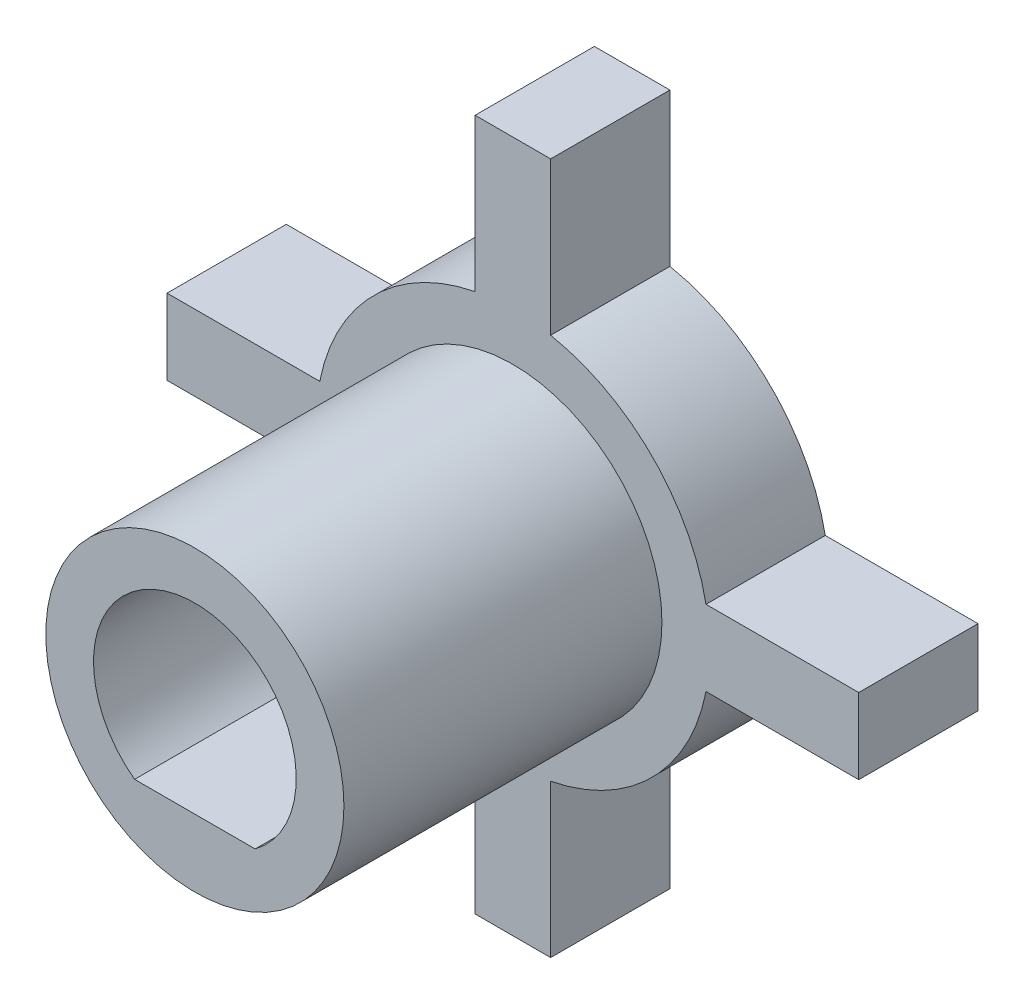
SolidWorks part; units mm, degrees
ref_plane "前视基准面" through (0, 0, 0) normal (0, 0, 1) x (1, 0, 0)
ref_plane "上视基准面" through (0, 0, 0) normal (0, 1, 0) x (1, 0, 0)
ref_plane "右视基准面" through (0, 0, 0) normal (1, 0, 0) x (0, 0, -1)
other "Configuration Table"
sketch "草图1" plane through (0, 0, 0) normal (0, 0, 1) x (1, 0, 0)
  line L1 (-1.9, -17.4) -> (1.9, -17.4)
  line L2 (-1.9, -17.4) -> (-1.9, -9.716)
  line L3 (-1.9, 17.4) -> (1.9, 17.4)
  line L4 (1.9, -17.4) -> (1.9, -9.716)
  line L7 (-17.4, 1.9) -> (-9.716, 1.9)
  line L8 (-17.4, 1.9) -> (-17.4, -1.9)
  line L9 (-17.4, -1.9) -> (-9.716, -1.9)
  line L10 (17.4, 1.9) -> (17.4, -1.9)
  line L20 (9.716, -1.9) -> (17.4, -1.9)
  line L23 (9.716, 1.9) -> (17.4, 1.9)
  line L24 (1.9, 9.716) -> (1.9, 17.4)
  line L27 (-1.9, 9.716) -> (-1.9, 17.4)
  arc A0 (-9.716, -1.9) -> (-1.9, -9.716) centre (0, 0) ccw
  arc A1 (1.9, -9.716) -> (9.716, -1.9) centre (0, 0) ccw
  arc A2 (9.716, 1.9) -> (1.9, 9.716) centre (0, 0) ccw
  arc A3 (-1.9, 9.716) -> (-9.716, 1.9) centre (0, 0) ccw
  dimension "D1" = 19.8
  dimension "D2" = 3.8
  dimension "D3" = 34.8
  dimension "D4" = 34.8
  dimension "D5" = 3.8
extrude "凸台-拉伸1" add sketch "草图1" along normal blind 6
sketch "草图2" plane through (0, 0, 6) normal (0, 0, 1) x (1, 0, 0)
  circle A0 centre (0, 0) radius 7.5
  dimension "D1" = 15
extrude "凸台-拉伸2" add sketch "草图2" along normal blind 16
sketch "草图3" plane through (0, 0, 22) normal (0, 0, 1) x (1, 0, 0)
  line L0 (-3.0332, -4.1) -> (3.0332, -4.1)
  arc A0 (3.0332, -4.1) -> (-3.0332, -4.1) centre (0, 0) ccw
  dimension "D2" = 10.2
  dimension "D1" = 4.1
extrude "切除-拉伸1" cut sketch "草图3" against normal through all
